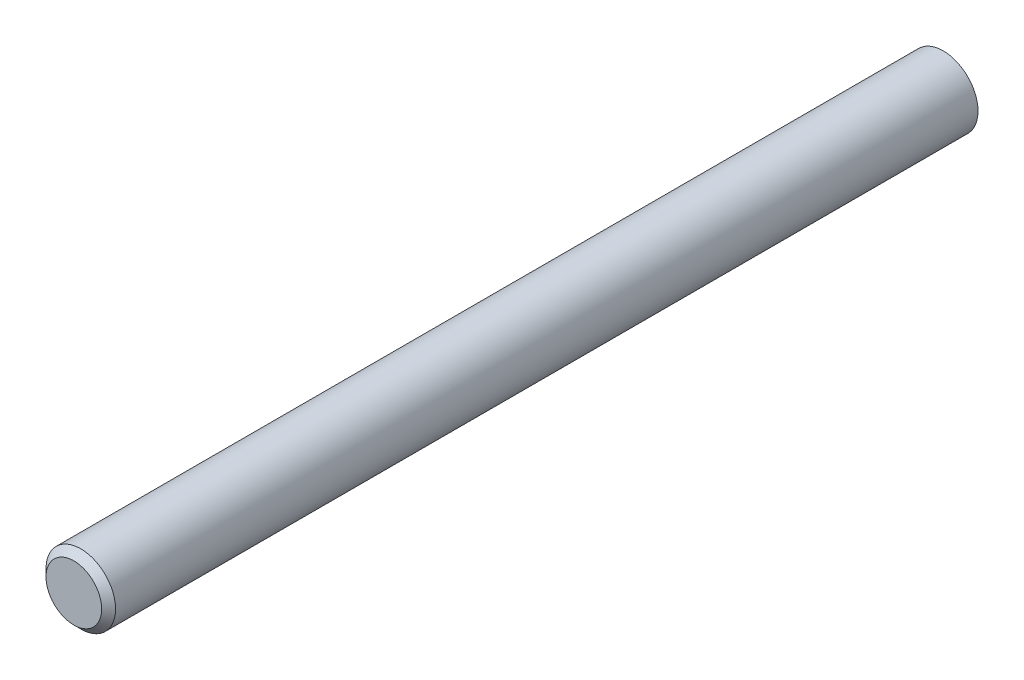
SolidWorks part; units mm, degrees
ref_plane "Front Plane" through (0, 0, 0) normal (0, 0, 1) x (1, 0, 0)
ref_plane "Top Plane" through (0, 0, 0) normal (0, 1, 0) x (1, 0, 0)
ref_plane "Right Plane" through (0, 0, 0) normal (1, 0, 0) x (0, 0, -1)
sketch "Sketch1" plane through (0, 0, 0) normal (0, 0, 1) x (1, 0, 0)
  circle A0 centre (0, 0) radius 2
  dimension "D1" = 4
extrude "Boss-Extrude1" add sketch "Sketch1" along normal mid plane 50
chamfer "Chamfer1" distance 0.4 angle 45 1 edges at (2, 0, 25)
